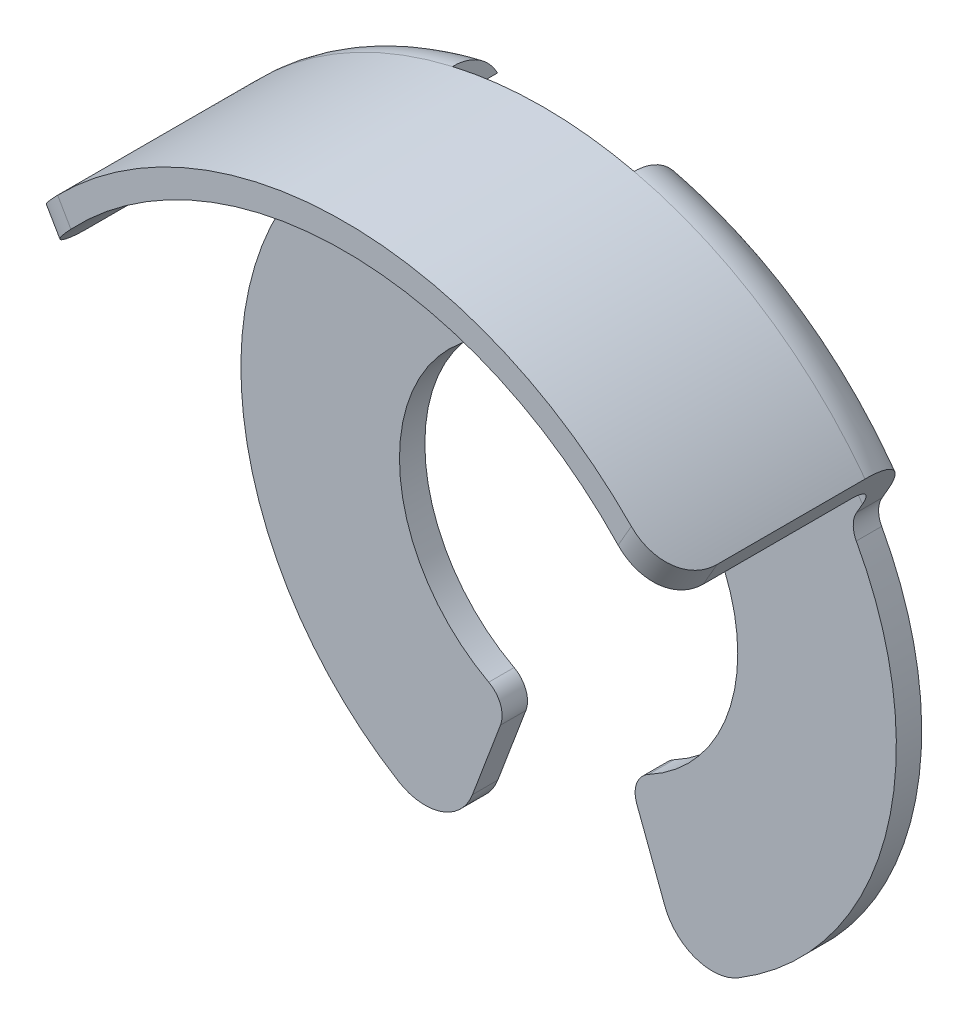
SolidWorks part; units mm, degrees
ref_plane "Front Plane" through (0, 0, 0) normal (0, 0, 1) x (1, 0, 0)
ref_plane "Top Plane" through (0, 0, 0) normal (0, 1, 0) x (1, 0, 0)
ref_plane "Right Plane" through (0, 0, 0) normal (1, 0, 0) x (0, 0, -1)
sketch "Sketch1" plane through (0, 0, 0) normal (0, 0, 1) x (1, 0, 0)
  circle A0 centre (0, 0) radius 4
  circle A1 centre (0, 0) radius 9.5
  dimension "D1" = 8
  dimension "D2" = 19
extrude "Boss-Extrude1" add sketch "Sketch1" against normal blind 5.9
sketch "Sketch2" plane through (0, 0, 0) normal (0, 0, 1) x (1, 0, 0)
  circle A0 centre (0, 0) radius 8.9
  dimension "D1" = 17.8
extrude "Cut-Extrude1" cut sketch "Sketch2" against normal blind 5.3
sketch "Sketch3" plane through (0, 0, 0) normal (0, 0, 1) x (1, 0, 0)
  line L0 (-7.611, 5.6853) -> (-6.638, 4)
  line L1 (7.611, 5.6853) -> (6.638, 4)
  circle A0 centre (0, 0) radius 9.5 construction
  arc A1 (-6.638, 4) -> (6.638, 4) centre (0, 0) ccw
  circle A2 centre (0, 0) radius 4 construction
  arc A4 (-7.611, 5.6853) -> (7.611, 5.6853) centre (0, 0) ccw
  point P7 (-7.75, 0)
  point P9 (7.75, 0)
  point P10 (0, 4)
  dimension "D1" = 60
  dimension "D2" = 15.5
extrude "Cut-Extrude2" cut sketch "Sketch3" against normal through all
sketch "Sketch4" plane through (0, 0, -5.3) normal (0, 0, 1) x (1, 0, 0)
  line L0 (0, 0) -> (-1.4131, -3.7421) construction
  line L1 (0, 0) -> (1.4131, -3.7421) construction
  line L2 (-1.4131, 3.7421) -> (-2.687, 7.1155)
  line L3 (0, 0) -> (-1.4131, 3.7421) construction
  line L4 (0, 0) -> (1.4131, 3.7421) construction
  line L5 (2.687, 7.1155) -> (1.4131, 3.7421)
  line L6 (1.4131, 3.7421) -> (1.4131, -3.7421) construction
  line L7 (-1.4131, 3.7421) -> (-1.4131, -3.7421) construction
  line L8 (-1.4131, -3.7421) -> (-2.2748, -6.0239)
  line L9 (1.4131, -3.7421) -> (2.2748, -6.0239)
  arc A0 (1.8082, 8.7144) -> (-1.8082, 8.7144) centre (0, 0) ccw
  arc A1 (7.2824, 5.1163) -> (-7.2824, 5.1163) centre (0, 0) ccw construction
  arc A2 (-1.4131, 3.7421) -> (-1.4131, -3.7421) centre (0, 0) ccw
  circle A3 centre (0, 0) radius 4 construction
  arc A4 (-2.687, 7.1155) -> (-1.8082, 8.7144) centre (-1.5644, 7.5394) cw
  arc A6 (1.8082, 8.7144) -> (2.687, 7.1155) centre (1.5644, 7.5394) cw
  arc A7 (-2.2748, -6.0239) -> (-4.0199, -6.626) centre (-3.3974, -5.6) cw
  arc A8 (-6.638, 4) -> (6.638, 4) centre (0, 0) ccw construction
  arc A9 (2.2748, -6.0239) -> (4.0199, -6.626) centre (3.3974, -5.6) ccw
  arc A10 (4.0199, -6.626) -> (-4.0199, -6.626) centre (0, 0) cw
  arc A11 (7.611, 5.6853) -> (-7.611, 5.6853) centre (0, 0) ccw construction
  arc A12 (1.4131, -3.7421) -> (1.4131, 3.7421) centre (0, 0) ccw
  point P1 (-3.3974, -6.8)
  point P30 (3.3974, -6.8)
  point P31 (0, 9.5)
  dimension "D2" = 1.2
  dimension "D1" = 16.3
extrude "Cut-Extrude3" cut sketch "Sketch4" against normal up to vertex
fillet "Fillet1" radius 1.2 3 edges at (0, 9.5, -5.9) (7.4467, 5.4008, 0) (-7.4467, 5.4008, 0)
fillet "Fillet2" radius 0.6 8 edges at (4.8884, 7.4373, -5.3) (-4.8884, 7.4373, -5.3) (-1.4131, -3.7421, -5.6) (1.4131, -3.7421, -5.6) (-1.4131, 3.7421, -5.6) (1.4131, 3.7421, -5.6) (-6.638, 4, -5.6) (6.638, 4, -5.6)
sketch "Sketch5" plane through (0, -4.5, -5.9) normal (0, 0, 1) x (1, 0, 0)
  line L0 (-2.1491, 10.191) -> (-2.1491, 14)
  line L5 (2.1491, 10.191) -> (2.1491, 14)
  line L6 (2.1491, 10.191) -> (-2.1491, 10.191)
  line L7 (1.6112, 8.7666) -> (2.687, 11.6155) construction
  line L8 (-2.687, 11.6155) -> (-1.6112, 8.7666) construction
  line L10 (-2.1491, 14) -> (2.1491, 14)
  arc A0 (7.611, 10.1853) -> (-7.611, 10.1853) centre (0, 4.5) ccw construction
extrude "Cut-Extrude5" cut sketch "Sketch5" along normal blind 1.2
